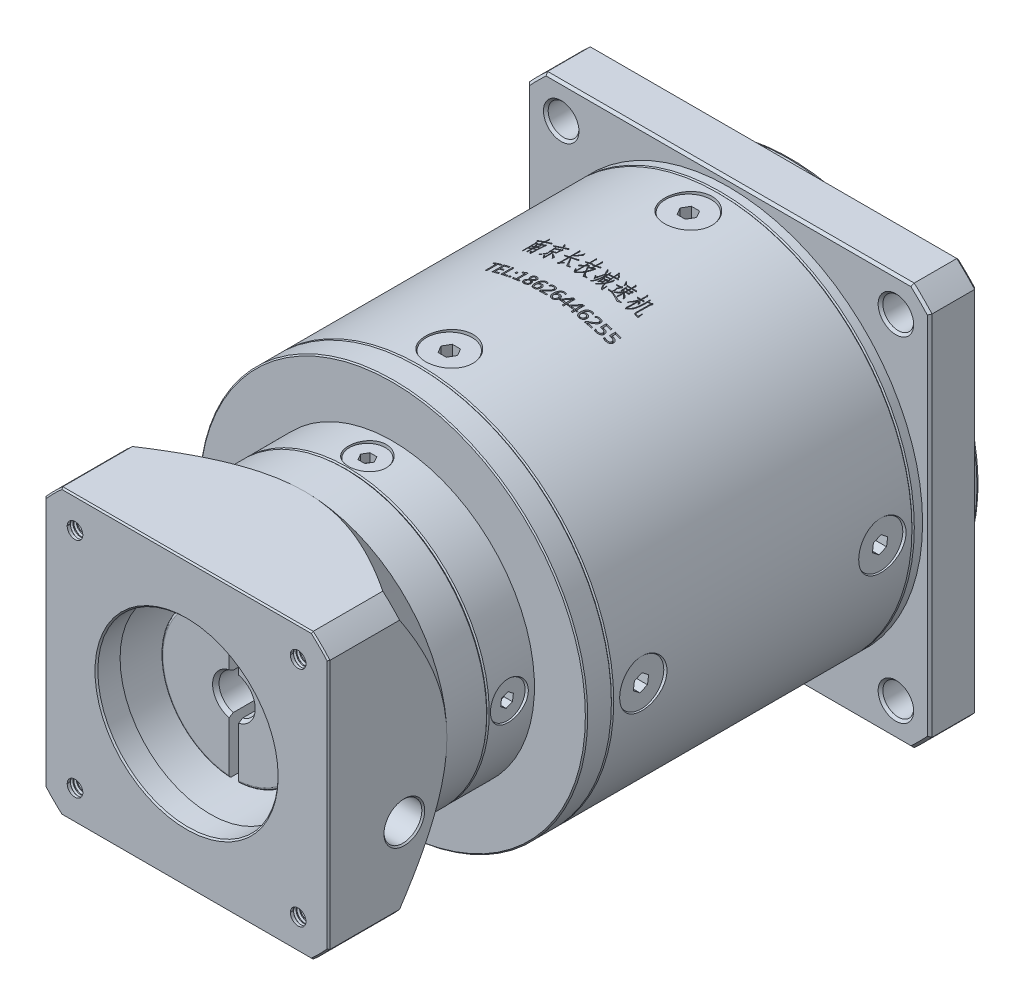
SolidWorks part; units mm, degrees
ref_plane "前视基准面" through (0, 0, 0) normal (0, 0, 1) x (1, 0, 0)
ref_plane "上视基准面" through (0, 0, 0) normal (0, 1, 0) x (1, 0, 0)
ref_plane "右视基准面" through (0, 0, 0) normal (1, 0, 0) x (0, 0, -1)
imported_body "8-38.1-47.14X47.14-M4-1-solid1"
imported_body "8-38.1-47.14X47.14-M4-1-solid2"
imported_body "8-38.1-47.14X47.14-M4-1-solid3"
imported_body "8-38.1-47.14X47.14-M4-1-solid4"
imported_body "8-38.1-47.14X47.14-M4-1-solid5"
imported_body "ZF80-K15-L3-F60-3-solid1"
imported_body "ZF80-K15-L3-F60-3-solid2"
imported_body "ZF80-K15-L3-F60-3-solid3"
imported_body "ZF80-K15-L3-F60-3-solid4"
imported_body "ZF80-K15-L3-F60-3-solid5"
imported_body "ZF80-K15-L3-F60-3-solid6"
imported_body "ZF80-K15-L3-F60-3-solid7"
imported_body "ZF80-K15-L3-F60-3-solid8"
imported_body "ZF80-K15-L3-F60-3-solid9"
imported_body "ZF80-K15-L3-F60-3-solid10"
imported_body "ZF80-K15-L3-F60-3-solid11"
imported_body "ZF80-K15-L3-F60-3-solid12"
imported_body "ZF80-K15-L3-F60-3-solid13"
sketch "草图1" plane through (0, 0, -70.9184) normal (0, 0, -1) x (-1, 0, 0)
  circle A0 centre (63.0095, 20.5162) radius 10.871
  dimension "D1" = 21.742
extrude "凸台-拉伸1" add sketch "草图1" along normal blind 5
